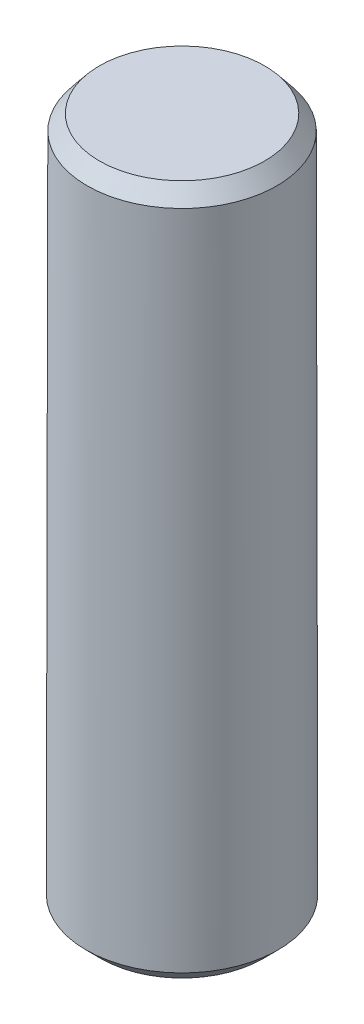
SolidWorks part; units mm, degrees
ref_plane "正面" through (0, 0, 0) normal (0, 0, 1) x (1, 0, 0)
ref_plane "平面" through (0, 0, 0) normal (0, 1, 0) x (1, 0, 0)
ref_plane "右側面" through (0, 0, 0) normal (1, 0, 0) x (0, 0, -1)
sketch "ｽｹｯﾁ1" plane through (0, 0, 0) normal (0, 1, 0) x (1, 0, 0)
  circle A0 centre (0, 0) radius 3.15
extrude "ﾎﾞｽ - 押し出し1" add sketch "ｽｹｯﾁ1" along normal blind 22.7 draft 0.09
chamfer "面取り1" distance 0.5 angle 39 1 edges at (0, 22.7, 3.1143)
chamfer "面取り2" distance 0.5 angle 45 1 edges at (0, 0, 3.15)
